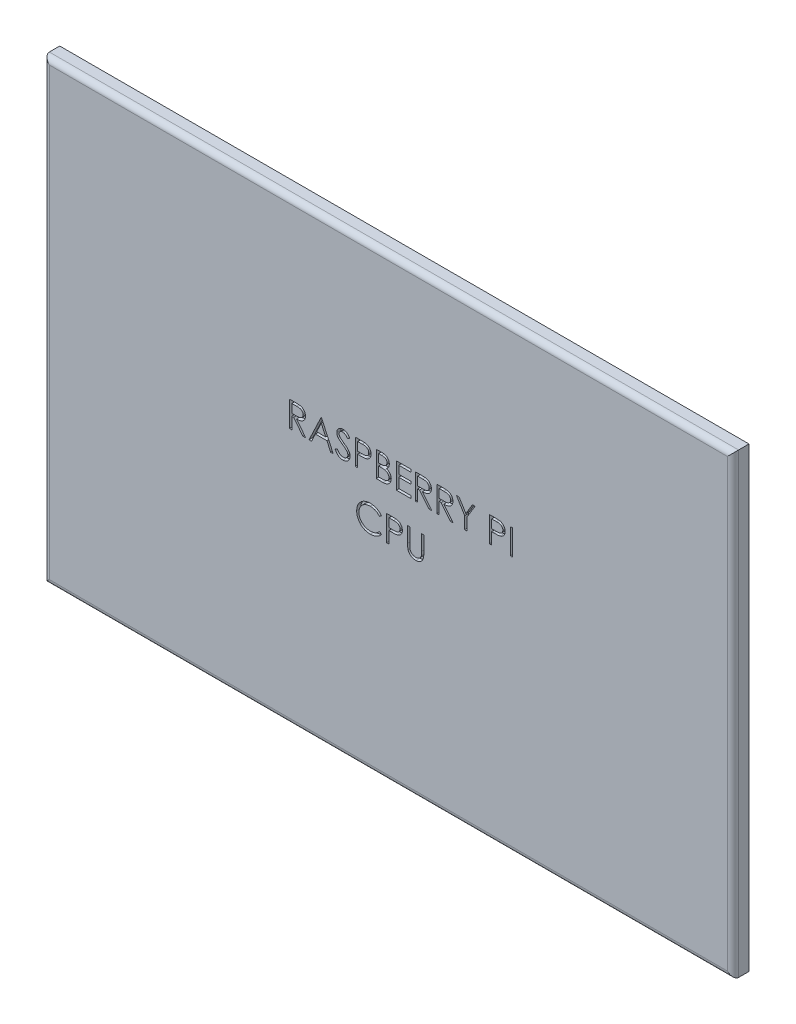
SolidWorks part; units mm, degrees
ref_plane "Front Plane" through (0, 0, 0) normal (0, 0, 1) x (1, 0, 0)
ref_plane "Top Plane" through (0, 0, 0) normal (0, 1, 0) x (1, 0, 0)
ref_plane "Right Plane" through (0, 0, 0) normal (1, 0, 0) x (0, 0, -1)
sketch "Sketch1" plane through (0, 0, 0) normal (0, 0, 1) x (1, 0, 0)
  line L5 (-34.133, 15.3503) -> (51.867, 15.3503)
  line L6 (-34.133, 15.3503) -> (-34.133, -41.6497)
  line L7 (-34.133, -41.6497) -> (51.867, -41.6497)
  line L8 (51.867, 15.3503) -> (51.867, -41.6497)
  dimension "D1" = 86
  dimension "D2" = 57
extrude "Boss-Extrude1" add sketch "Sketch1" along normal blind 2
sketch "Sketch2" plane through (0, 0, 2) normal (0, 0, 1) x (1, 0, 0)
  text T0 "RASPBERRY PI          CPU"
extrude "Cut-Extrude1" cut sketch "Sketch2" against normal blind 0.5
fillet "Fillet1" radius 0.7 4 edges at (8.867, -41.6497, 2) (51.867, -13.1497, 2) (8.867, 15.3503, 2) (-34.133, -13.1497, 2)
